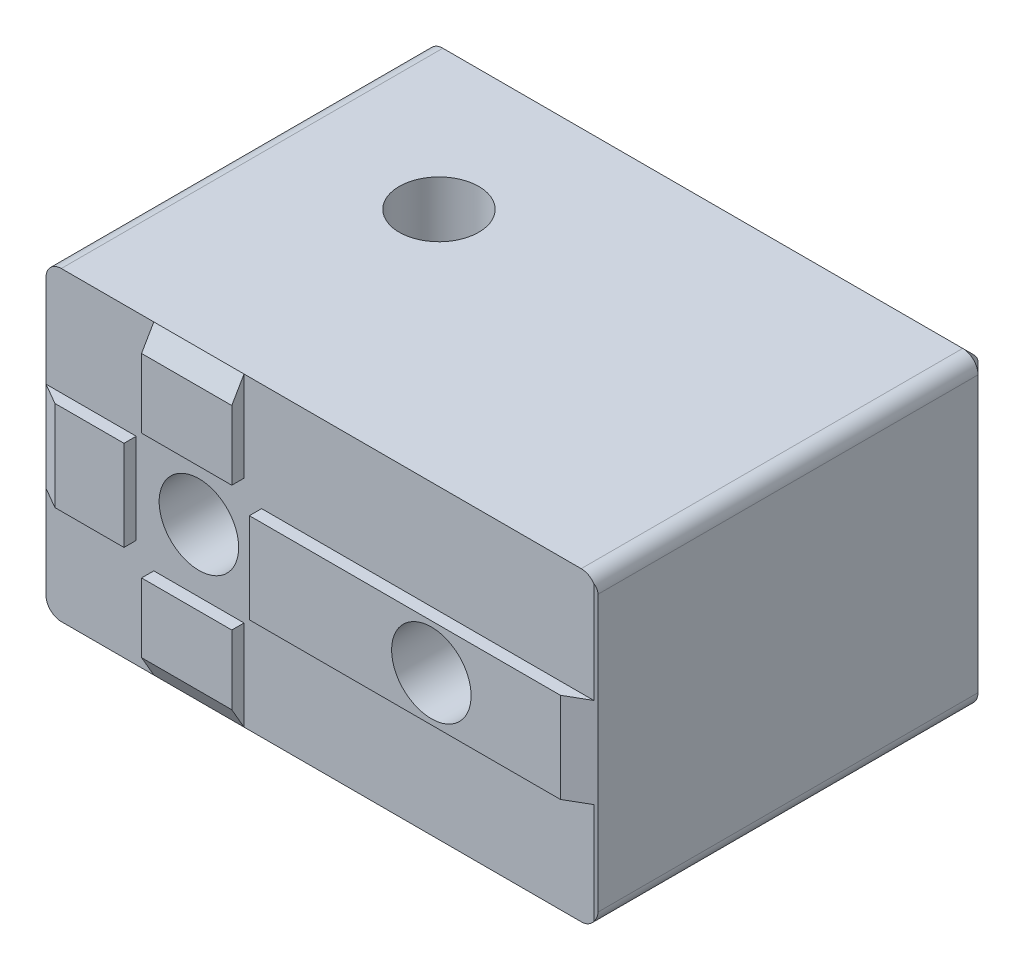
SolidWorks part; units mm, degrees
other "Cut-Extrude6"
ref_plane "Front Plane" through (0, 0, 0) normal (0, 0, 1) x (1, 0, 0)
ref_plane "Top Plane" through (0, 0, 0) normal (0, 1, 0) x (1, 0, 0)
ref_plane "Right Plane" through (0, 0, 0) normal (1, 0, 0) x (0, 0, -1)
imported_body "Imported1"
sketch "Sketch1" plane through (0, 0, 0) normal (0, 0, -1) x (-1, 0, 0)
  circle A0 centre (-16, 0) radius 5
  dimension "D1" = 10
extrude "Cut-Extrude1" cut sketch "Sketch1" against normal up to surface (5 mm away)
sketch "Sketch2" plane through (0, 0, 0) normal (0, 0, -1) x (-1, 0, 0)
  circle A0 centre (0, 0) radius 5
  dimension "D1" = 10
extrude "Cut-Extrude2" cut sketch "Sketch2" against normal up to surface (22 mm away) contours A0
chamfer "Chamfer1" distance 0.75 angle 45 10 edges at (-9.7071, -9.7071, 0) (8, -10, 0) (25.7071, -9.7071, 0) (26, 0, 0) (25.7071, 9.7071, 0) (8, 10, 0) (-9.7071, 9.7071, 0) (-10, 0, 0) (11, 0, 0) (-5, 0, 0)
sketch "Sketch3" [suppressed] plane through (0, 0, 22) normal (0, 0, -1) x (-1, 0, 0)
  circle A0 centre (0, 0) radius 2.6 construction
  circle A1 centre (0, 0) radius 2.6
extrude "Boss-Extrude1" [suppressed] add sketch "Sketch3" against normal blind 0.2
sketch "Sketch4" [suppressed] plane through (0, 0, 5) normal (0, 0, -1) x (-1, 0, 0)
  circle A0 centre (-16, 0) radius 2.6 construction
  circle A1 centre (-16, 0) radius 2.6
extrude "Boss-Extrude2" [suppressed] add sketch "Sketch4" against normal blind 0.2
mirror "Mirror1" [suppressed]
delete or keep bodies "Body-Delete/Keep 1" [suppressed] type delete bodies bodies 103
